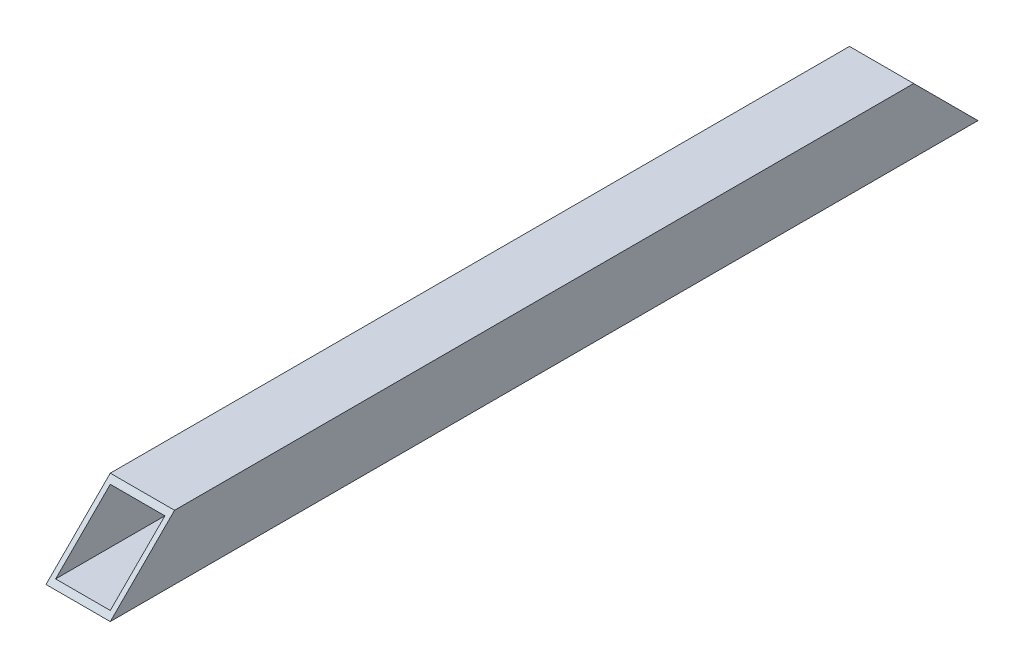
SolidWorks part; units mm, degrees
ref_plane "Plan de face" through (0, 0, 0) normal (0, 0, 1) x (1, 0, 0)
ref_plane "Plan de dessus" through (0, 0, 0) normal (0, 1, 0) x (1, 0, 0)
ref_plane "Plan de droite" through (0, 0, 0) normal (1, 0, 0) x (0, 0, -1)
sketch "Esquisse1" plane through (0, 0, 0) normal (0, 0, 1) x (1, 0, 0)
  line L1 (0, 0) -> (40, 0)
  line L2 (0, 0) -> (0, 40)
  line L3 (0, 40) -> (40, 40)
  line L4 (40, 0) -> (40, 40)
  line L5 (3, 37) -> (37, 37)
  line L6 (3, 37) -> (3, 3)
  line L7 (3, 3) -> (37, 3)
  line L8 (37, 37) -> (37, 3)
  dimension "D1" = 40
  dimension "D2" = 40
  dimension "D3" = 3
  dimension "D4" = 3
  dimension "D5" = 3
  dimension "D6" = 3
extrude "Extrusion1" add sketch "Esquisse1" along normal blind 540
chamfer "Chanfrein1" distance 40 distance2 40 1 edges at (20, 40, 540)
chamfer "Chanfrein2" distance 40 distance2 40 1 edges at (20, 40, 0)
